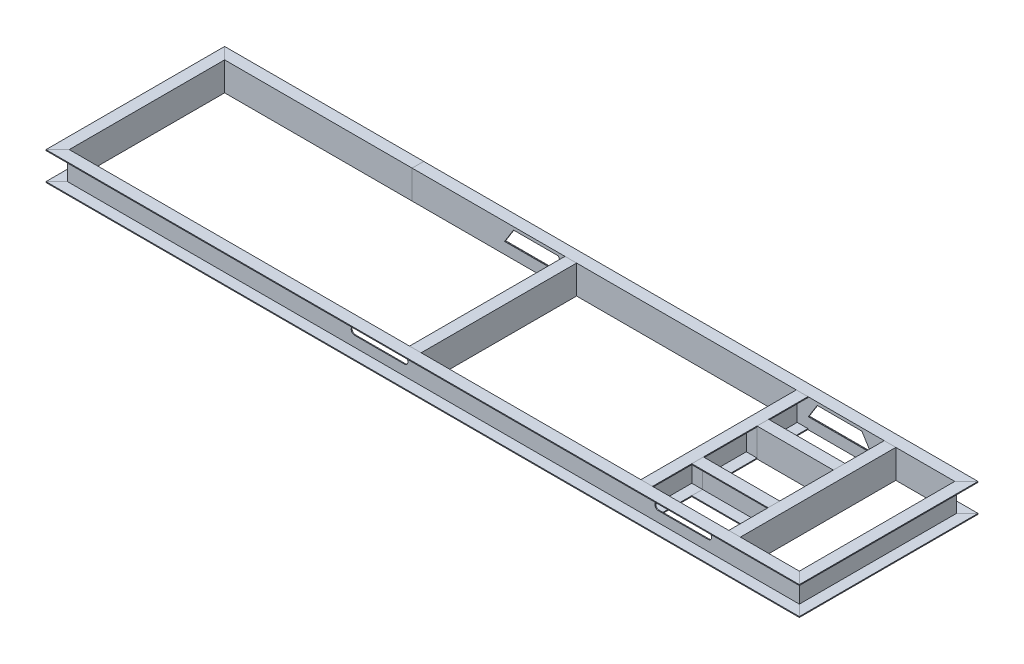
SolidWorks part; units mm, degrees
ref_plane "Front Plane" through (0, 0, 0) normal (0, 0, 1) x (1, 0, 0)
ref_plane "Top Plane" through (0, 0, 0) normal (0, 1, 0) x (1, 0, 0)
ref_plane "Right Plane" through (0, 0, 0) normal (1, 0, 0) x (0, 0, -1)
sketch "Sketch1" plane through (0, 0, 0) normal (1, 0, 0) x (0, 0, -1)
  line L0 (65, 160) -> (0, 160)
  line L1 (0, 160) -> (0, 0)
  line L2 (0, 0) -> (65, 0)
  line L3 (65, 0) -> (65, 5)
  line L4 (65, 5) -> (5, 5)
  line L5 (5, 5) -> (5, 155)
  line L6 (5, 155) -> (65, 155)
  line L7 (65, 155) -> (65, 160)
  dimension "D1" = 160
  dimension "D2" = 65
  dimension "D3" = 5
  dimension "D4" = 5
sketch "Sketch2" plane through (0, 0, 0) normal (0, 1, 0) x (1, 0, 0)
  line L0 (0, 0) -> (3037.5843, 0)
  line L1 (3037.5843, 0) -> (3037.5843, -870)
  line L2 (3037.5843, -870) -> (-1049.4157, -870)
  line L3 (-1049.4157, -870) -> (-1049.4157, 0)
  line L4 (-1049.4157, 0) -> (0, 0)
  dimension "D1" = 4087
  dimension "D2" = 870
sweep "Sweep1" add profiles "Sketch1" path "Sketch2"
sketch "Sketch3" plane through (0, 0, 0) normal (0, 0, 1) x (1, 0, 0)
  line L0 (2642.5843, 160) -> (2707.5843, 160)
  line L1 (3037.5843, 160) -> (0, 160) construction
  line L2 (2707.5843, 160) -> (2707.5843, 0)
  line L3 (3037.5843, 0) -> (0, 0) construction
  line L4 (2707.5843, 0) -> (2642.5843, 0)
  line L5 (2642.5843, 0) -> (2642.5843, 5)
  line L6 (2642.5843, 5) -> (2702.5843, 5)
  line L7 (2702.5843, 5) -> (2702.5843, 155)
  line L8 (2702.5843, 155) -> (2642.5843, 155)
  line L9 (2642.5843, 155) -> (2642.5843, 160)
  line L10 (3037.5843, 0) -> (3037.5843, 160) construction
  dimension "D1" = 160
  dimension "D2" = 65
  dimension "D3" = 5
  dimension "D4" = 5
  dimension "D5" = 330
extrude "Boss-Extrude1" add sketch "Sketch3" along normal up to surface (870 mm away) separate body
sketch "Sketch6" plane through (0, 0, 0) normal (0, 0, 1) x (1, 0, 0)
  line L0 (2215.5843, 160) -> (2150.5843, 160)
  line L1 (-1114.4157, 160) -> (3102.5843, 160) construction
  line L2 (2150.5843, 160) -> (2150.5843, 0)
  line L3 (-1114.4157, 0) -> (3102.5843, 0) construction
  line L4 (2150.5843, 0) -> (2215.5843, 0)
  line L5 (2215.5843, 0) -> (2215.5843, 5)
  line L6 (2215.5843, 5) -> (2155.5843, 5)
  line L7 (2155.5843, 5) -> (2155.5843, 155)
  line L8 (2155.5843, 155) -> (2215.5843, 155)
  line L9 (2215.5843, 155) -> (2215.5843, 160)
  dimension "D1" = 65
  dimension "D2" = 5
  dimension "D3" = 5
  dimension "D4" = 427
extrude "Boss-Extrude2" add sketch "Sketch6" along normal up to surface (870 mm away) separate body
sketch "Sketch7" plane through (0, 0, 0) normal (0, 0, 1) x (1, 0, 0)
  line L0 (855.5843, 160) -> (920.5843, 160)
  line L1 (-1114.4157, 160) -> (3102.5843, 160) construction
  line L2 (920.5843, 160) -> (920.5843, 0)
  line L3 (-1114.4157, 0) -> (3102.5843, 0) construction
  line L4 (920.5843, 0) -> (855.5843, 0)
  line L5 (855.5843, 0) -> (855.5843, 5)
  line L6 (855.5843, 5) -> (915.5843, 5)
  line L7 (915.5843, 5) -> (915.5843, 155)
  line L8 (915.5843, 155) -> (855.5843, 155)
  line L9 (855.5843, 155) -> (855.5843, 160)
  dimension "D1" = 65
  dimension "D2" = 5
  dimension "D3" = 5
  dimension "D4" = 2247
extrude "Boss-Extrude3" add sketch "Sketch7" along normal up to surface (870 mm away) separate body contours L7 L8 L9 L0 L2 L4 L5 L6
ref_plane "Plane1" through (0, 0, 435) normal (0, 0, 1) x (1, 0, 0)
sketch "Sketch9" plane through (2215.5843, 0, 0) normal (1, 0, 0) x (0, 0, -1)
  line L0 (-650, 160) -> (-650, 155)
  line L1 (-870, 160) -> (0, 160) construction
  line L2 (-870, 155) -> (0, 155) construction
  line L3 (-650, 155) -> (-590, 155)
  line L4 (-590, 155) -> (-590, 5)
  line L5 (-870, 5) -> (0, 5) construction
  line L6 (-590, 5) -> (-650, 5)
  line L7 (-650, 5) -> (-650, 0)
  line L8 (-870, 0) -> (0, 0) construction
  line L9 (-650, 0) -> (-585, 0)
  line L10 (-585, 0) -> (-585, 160)
  line L11 (-585, 160) -> (-650, 160)
  line L12 (-435, 88) -> (-435, -88) construction
  dimension "D1" = 5
  dimension "D2" = 65
  dimension "D3" = 215
extrude "Boss-Extrude4" add sketch "Sketch9" along normal up to surface (427 mm away) separate body contours L4 L6 L7 L9 L10 L11 L0 L3
sketch "Sketch11" plane through (2642.5843, 0, 0) normal (1, 0, 0) x (0, 0, -1)
  line L0 (-590, 155) -> (-590, 5) construction
  line L1 (-585, 5) -> (-590, 5)
  line L2 (-585, 5) -> (-585, 155)
  line L3 (-585, 155) -> (-590, 155)
  line L4 (-590, 5) -> (-590, 155)
  line L5 (-870, 5) -> (0, 5) construction
  line L6 (-585, 0) -> (-585, 160) construction
  dimension "D1" = 150
extrude "Boss-Extrude5" add sketch "Sketch11" along normal blind 60 separate body contours L2 L3 L4 L1
sketch "Sketch12" plane through (2215.5843, 0, 0) normal (-1, 0, 0) x (0, 0, 1)
  line L0 (585, 0) -> (585, 160) construction
  line L1 (590, 5) -> (585, 5)
  line L2 (590, 5) -> (590, 155)
  line L3 (590, 155) -> (585, 155)
  line L4 (585, 5) -> (585, 155)
  line L5 (590, 155) -> (590, 5) construction
  line L6 (590, 5) -> (650, 5) construction
  dimension "D1" = 150
extrude "Boss-Extrude6" add sketch "Sketch12" along normal blind 60 separate body
mirror "Mirror2" about plane through (0, 0, 435) normal (0, 0, 1)
sketch "Sketch13" plane through (0, 0, 875) normal (0, 0, 1) x (1, 0, 0)
  line L0 (3042.5843, 155) -> (3042.5843, 5) construction
  line L1 (2217.5843, 63.3333) -> (2567.5843, 63.3333)
  line L2 (2217.5843, 63.3333) -> (2267.5843, 143.3333)
  line L3 (2267.5843, 143.3333) -> (2517.5843, 143.3333)
  line L4 (2567.5843, 63.3333) -> (2517.5843, 143.3333)
  line L5 (2217.5843, 63.3333) -> (2517.5843, 143.3333) construction
  line L6 (2267.5843, 143.3333) -> (2567.5843, 63.3333) construction
  line L7 (-1114.4157, 0) -> (3102.5843, 0) construction
  line L8 (2392.5843, 110) -> (2392.5843, 143.3333) construction
  point P0 (2392.5843, 110)
  dimension "D1" = 650
  dimension "D2" = 110
  dimension "D3" = 350
  dimension "D4" = 250
  dimension "D5" = 80
extrude "Cut-Extrude1" cut sketch "Sketch13" against normal through all
fillet "Fillet1" radius 20 4 edges at (2567.5843, 63.3333, 872.5) (2217.5843, 63.3333, 872.5) (2517.5843, 143.3333, 872.5) (2267.5843, 143.3333, 872.5)
pattern_linear "LPattern1" count 2 spacing 1700 along (-1, 0, 0) of "Cut-Extrude1", "Fillet1"
